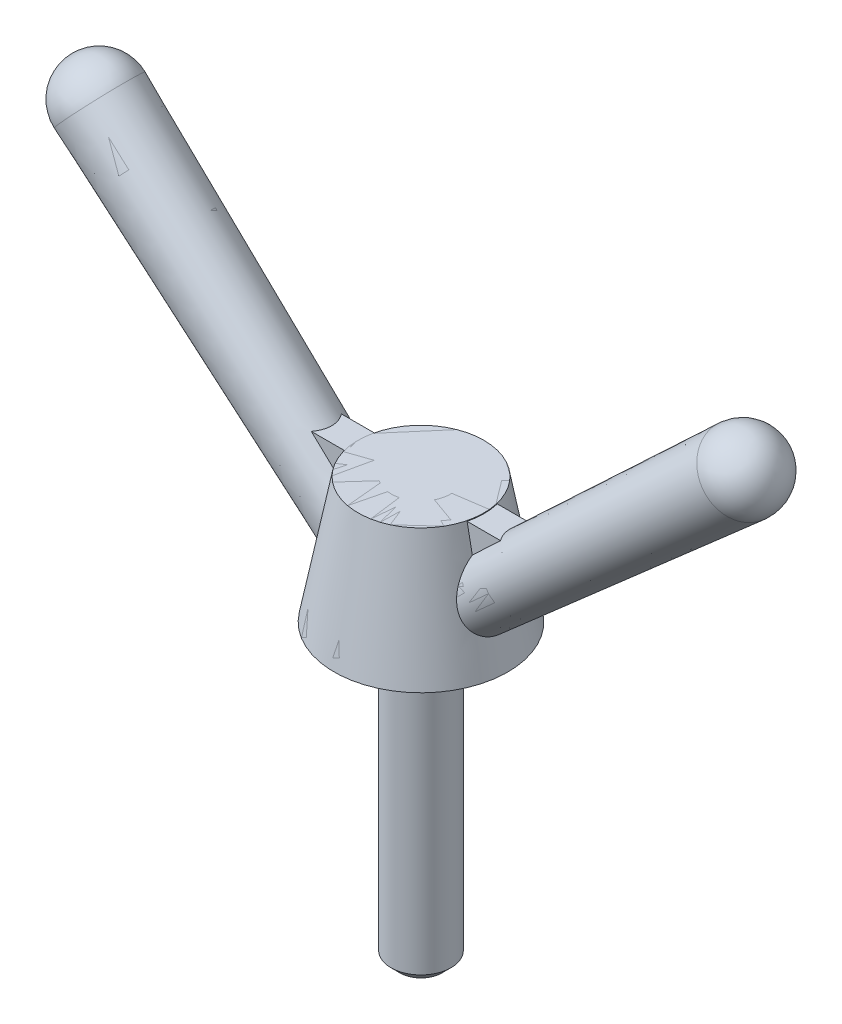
SolidWorks part; units mm, degrees
ref_plane "Front" through (0, 0, 0) normal (0, 0, 1) x (1, 0, 0)
ref_plane "Top" through (0, 0, 0) normal (0, 1, 0) x (1, 0, 0)
ref_plane "Right" through (0, 0, 0) normal (1, 0, 0) x (0, 0, -1)
imported_body "Imported1"
sketch "Esquisse1" plane through (0, 21, 0) normal (0, 1, 0) x (-1, 0, 0)
  circle A0 centre (0, 0) radius 5
  circle A3 centre (0, 0) radius 5 construction
extrude "Extrusion1" add sketch "Esquisse1" against normal blind 70
chamfer "Chanfrein1" distance 1.5 angle 45
